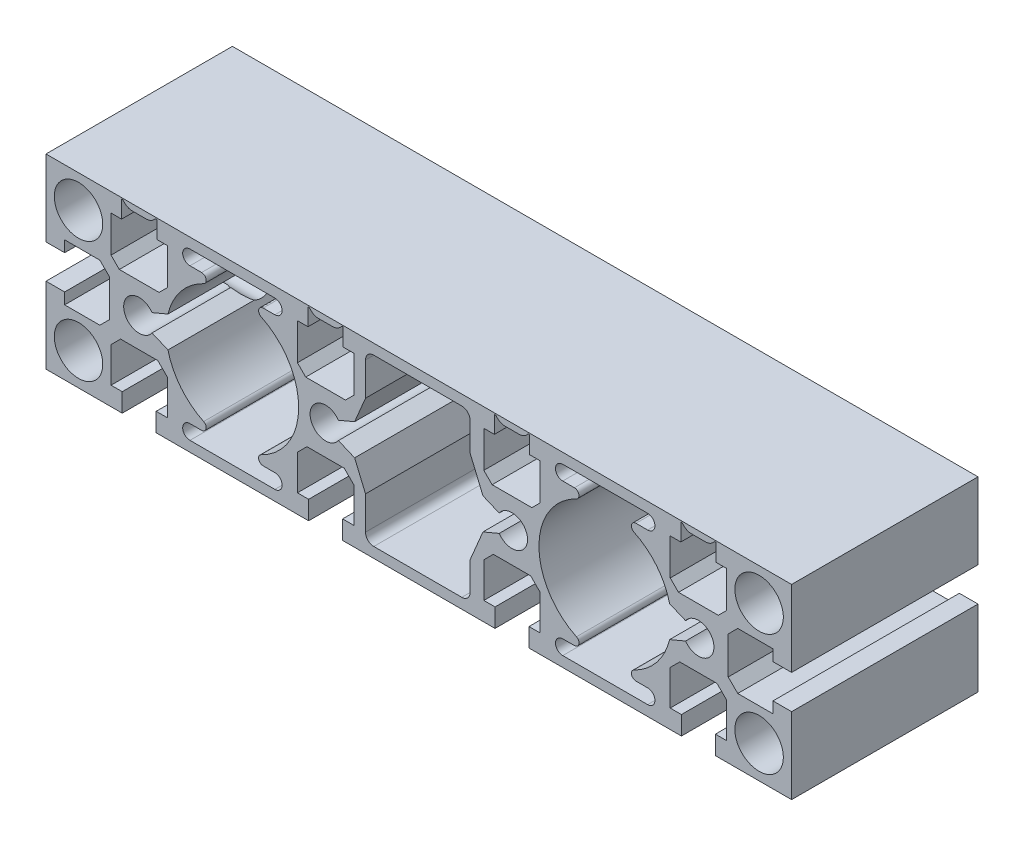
SolidWorks part; units mm, degrees
ref_plane "Front Plane" through (0, 0, 0) normal (0, 0, 1) x (1, 0, 0)
ref_plane "Top Plane" through (0, 0, 0) normal (0, 1, 0) x (1, 0, 0)
ref_plane "Right Plane" through (0, 0, 0) normal (1, 0, 0) x (0, 0, -1)
sketch "Sketch1" plane through (0, 0, 0) normal (0, 0, 1) x (1, 0, 0)
  line L14 (-71.45, 22.2) -> (-70.9822, 21.7322)
  line L15 (-71.75, 22.2) -> (-71.45, 22.2)
  line L16 (-71.75, 18) -> (-71.75, 22.2)
  line L17 (-74.3, 18) -> (-71.75, 18)
  line L18 (-74.3, 9.2) -> (-74.3, 18)
  line L19 (-72.3, 7.2) -> (-74.3, 9.2)
  line L20 (-62.7, 7.2) -> (-72.3, 7.2)
  line L21 (-60.7, 9.2) -> (-62.7, 7.2)
  line L22 (-60.7, 18) -> (-60.7, 9.2)
  line L23 (-63.25, 18) -> (-60.7, 18)
  line L24 (-63.25, 22.2) -> (-63.25, 18)
  line L25 (-63.55, 22.2) -> (-63.25, 22.2)
  line L26 (-64.0177, 21.7323) -> (-63.55, 22.2)
  line L27 (-69.2144, 21) -> (-65.7855, 21)
  line L42 (-26.45, 22.2) -> (-25.9822, 21.7322)
  line L43 (-26.75, 22.2) -> (-26.45, 22.2)
  line L44 (-26.75, 18) -> (-26.75, 22.2)
  line L45 (-29.3, 18) -> (-26.75, 18)
  line L46 (-29.3, 9.2) -> (-29.3, 18)
  line L47 (-27.3, 7.2) -> (-29.3, 9.2)
  line L48 (-17.7, 7.2) -> (-27.3, 7.2)
  line L49 (-15.7, 9.2) -> (-17.7, 7.2)
  line L50 (-15.7, 18) -> (-15.7, 9.2)
  line L51 (-18.25, 18) -> (-15.7, 18)
  line L52 (-18.25, 22.2) -> (-18.25, 18)
  line L53 (-18.55, 22.2) -> (-18.25, 22.2)
  line L54 (-19.0177, 21.7323) -> (-18.55, 22.2)
  line L55 (-24.2144, 21) -> (-20.7855, 21)
  line L128 (-90, 22.5) -> (-90, 4.1)
  line L129 (-90, 4.1) -> (-85.5, 4.1)
  line L130 (-85.5, 4.1) -> (-85.5, 6.8)
  line L131 (-85.5, 6.8) -> (-77, 6.8)
  line L132 (-77, 6.8) -> (-74.7, 4.5)
  line L133 (-74.7, 4.5) -> (-74.7, -4.5)
  line L134 (-74.7, -4.5) -> (-77, -6.8)
  line L135 (-77, -6.8) -> (-85.5, -6.8)
  line L136 (-85.5, -6.8) -> (-85.5, -4.1)
  line L137 (-85.5, -4.1) -> (-90, -4.1)
  line L138 (-90, -4.1) -> (-90, -22.5)
  line L139 (-90, -22.5) -> (-71.6, -22.5)
  line L140 (-71.6, -22.5) -> (-71.6, -18)
  line L141 (-71.6, -18) -> (-74.3, -18)
  line L142 (-74.3, -18) -> (-74.3, -9.5)
  line L143 (-74.3, -9.5) -> (-72, -7.2)
  line L144 (-72, -7.2) -> (-63, -7.2)
  line L145 (-63, -7.2) -> (-60.7, -9.5)
  line L146 (-60.7, -9.5) -> (-60.7, -18)
  line L147 (-60.7, -18) -> (-63.4, -18)
  line L148 (-63.4, -18) -> (-63.4, -22.5)
  line L149 (-63.4, -22.5) -> (-26.6, -22.5)
  line L150 (-26.6, -22.5) -> (-26.6, -18)
  line L151 (-26.6, -18) -> (-29.3, -18)
  line L152 (-29.3, -18) -> (-29.3, -9.5)
  line L153 (-29.3, -9.5) -> (-27, -7.2)
  line L154 (-27, -7.2) -> (-18, -7.2)
  line L155 (-18, -7.2) -> (-15.7, -9.5)
  line L156 (-15.7, -9.5) -> (-15.7, -18)
  line L157 (-15.7, -18) -> (-18.4, -18)
  line L158 (-18.4, -18) -> (-18.4, -22.5)
  line L159 (-18.4, -22.5) -> (18.4, -22.5)
  line L160 (18.4, -22.5) -> (18.4, -18)
  line L161 (18.4, -18) -> (15.7, -18)
  line L162 (15.7, -18) -> (15.7, -9.5)
  line L163 (15.7, -9.5) -> (18, -7.2)
  line L164 (18, -7.2) -> (27, -7.2)
  line L165 (27, -7.2) -> (29.3, -9.5)
  line L166 (29.3, -9.5) -> (29.3, -18)
  line L167 (29.3, -18) -> (26.6, -18)
  line L168 (26.6, -18) -> (26.6, -22.5)
  line L169 (26.6, -22.5) -> (63.4, -22.5)
  line L170 (63.4, -22.5) -> (63.4, -18)
  line L171 (63.4, -18) -> (60.7, -18)
  line L172 (60.7, -18) -> (60.7, -9.5)
  line L173 (60.7, -9.5) -> (63, -7.2)
  line L174 (63, -7.2) -> (72, -7.2)
  line L175 (72, -7.2) -> (74.3, -9.5)
  line L176 (74.3, -9.5) -> (74.3, -18)
  line L177 (74.3, -18) -> (71.6, -18)
  line L178 (71.6, -18) -> (71.6, -22.5)
  line L179 (71.6, -22.5) -> (90, -22.5)
  line L180 (90, -22.5) -> (90, -4.1)
  line L181 (90, -4.1) -> (85.5, -4.1)
  line L182 (85.5, -4.1) -> (85.5, -6.8)
  line L183 (85.5, -6.8) -> (77, -6.8)
  line L184 (77, -6.8) -> (74.7, -4.5)
  line L185 (74.7, -4.5) -> (74.7, 4.5)
  line L186 (74.7, 4.5) -> (77, 6.8)
  line L187 (77, 6.8) -> (85.5, 6.8)
  line L188 (85.5, 6.8) -> (85.5, 4.1)
  line L189 (85.5, 4.1) -> (90, 4.1)
  line L190 (90, 4.1) -> (90, 22.5)
  line L191 (90, 22.5) -> (-90, 22.5)
  line L198 (18.55, 22.2) -> (19.0177, 21.7323)
  line L199 (18.25, 22.2) -> (18.55, 22.2)
  line L200 (18.25, 18) -> (18.25, 22.2)
  line L201 (15.7, 18) -> (18.25, 18)
  line L202 (15.7, 9.2) -> (15.7, 18)
  line L203 (17.7, 7.2) -> (15.7, 9.2)
  line L204 (27.3, 7.2) -> (17.7, 7.2)
  line L205 (29.3, 9.2) -> (27.3, 7.2)
  line L206 (29.3, 18) -> (29.3, 9.2)
  line L207 (26.75, 18) -> (29.3, 18)
  line L208 (26.75, 22.2) -> (26.75, 18)
  line L209 (26.45, 22.2) -> (26.75, 22.2)
  line L210 (25.9822, 21.7322) -> (26.45, 22.2)
  line L211 (20.7855, 21) -> (24.2144, 21)
  line L226 (63.55, 22.2) -> (64.0177, 21.7323)
  line L227 (63.25, 22.2) -> (63.55, 22.2)
  line L228 (63.25, 18) -> (63.25, 22.2)
  line L229 (60.7, 18) -> (63.25, 18)
  line L230 (60.7, 9.2) -> (60.7, 18)
  line L231 (62.7, 7.2) -> (60.7, 9.2)
  line L232 (72.3, 7.2) -> (62.7, 7.2)
  line L233 (74.3, 9.2) -> (72.3, 7.2)
  line L234 (74.3, 18) -> (74.3, 9.2)
  line L235 (71.75, 18) -> (74.3, 18)
  line L236 (71.75, 22.2) -> (71.75, 18)
  line L237 (71.45, 22.2) -> (71.75, 22.2)
  line L238 (70.9822, 21.7322) -> (71.45, 22.2)
  line L239 (65.7855, 21) -> (69.2144, 21)
  line L248 (34.75, -16.5) -> (37.5774, -16.5)
  line L249 (55.25, -20) -> (34.75, -20)
  line L250 (52.4226, -16.5) -> (55.25, -16.5)
  line L251 (64.4102, -2.125) -> (60.5543, -3.75)
  line L252 (60.5543, 3.75) -> (64.4102, 2.125)
  line L253 (55.25, 16.5) -> (52.4226, 16.5)
  line L254 (34.75, 20) -> (55.25, 20)
  line L255 (37.5774, 16.5) -> (34.75, 16.5)
  line L270 (-15.4894, -3.7774) -> (-19.4102, -2.125)
  line L271 (-12.8669, -10) -> (-15.4894, -3.7774)
  line L272 (-12.8669, -18) -> (-12.8669, -10)
  line L273 (10.3831, -20) -> (-10.8669, -20)
  line L274 (12.3831, -11.1481) -> (12.3831, -18)
  line L275 (15.4894, -3.7774) -> (12.3831, -11.1481)
  line L276 (19.4102, -2.125) -> (15.4894, -3.7774)
  line L277 (15.4894, 3.7774) -> (19.4102, 2.125)
  line L278 (12.3831, 11.1481) -> (15.4894, 3.7774)
  line L279 (12.3831, 18) -> (12.3831, 11.1481)
  line L280 (-10.8669, 20) -> (10.3831, 20)
  line L281 (-12.8669, 10) -> (-12.8669, 18)
  line L282 (-15.4894, 3.7774) -> (-12.8669, 10)
  line L283 (-19.4102, 2.125) -> (-15.4894, 3.7774)
  line L292 (-52.4226, 16.5) -> (-55.25, 16.5)
  line L293 (-64.4102, 2.125) -> (-60.5543, 3.75)
  line L294 (-60.5543, -3.75) -> (-64.4102, -2.125)
  line L295 (-55.25, -16.5) -> (-52.4226, -16.5)
  line L296 (-34.75, -20) -> (-55.25, -20)
  line L297 (-37.5774, -16.5) -> (-34.75, -16.5)
  line L298 (-34.75, 16.5) -> (-37.5774, 16.5)
  line L299 (-55.25, 20) -> (-34.75, 20)
  circle A4 centre (82.15, 14.65) radius 5.85
  circle A5 centre (82.15, -14.65) radius 5.85
  circle A6 centre (-82.15, -14.65) radius 5.85
  circle A7 centre (-82.15, 14.65) radius 5.85
  arc A10 (-70.9822, 21.7322) -> (-69.2144, 21) centre (-69.2144, 23.5) ccw
  arc A11 (-65.7855, 21) -> (-64.0177, 21.7323) centre (-65.7855, 23.5) ccw
  arc A14 (-25.9822, 21.7322) -> (-24.2144, 21) centre (-24.2144, 23.5) ccw
  arc A15 (-20.7855, 21) -> (-19.0177, 21.7323) centre (-20.7855, 23.5) ccw
  arc A18 (19.0177, 21.7323) -> (20.7855, 21) centre (20.7855, 23.5) ccw
  arc A19 (24.2144, 21) -> (25.9822, 21.7322) centre (24.2144, 23.5) ccw
  arc A22 (64.0177, 21.7323) -> (65.7855, 21) centre (65.7855, 23.5) ccw
  arc A23 (69.2144, 21) -> (70.9822, 21.7322) centre (69.2144, 23.5) ccw
  arc A36 (37.5774, -16.5) -> (38.0539, -14.4136) centre (37.5774, -15.4024) ccw
  arc A37 (34.75, -16.5) -> (34.75, -20) centre (34.75, -18.25) ccw
  arc A38 (55.25, -20) -> (55.25, -16.5) centre (55.25, -18.25) ccw
  arc A39 (51.9461, -14.4136) -> (52.4226, -16.5) centre (52.4226, -15.4024) ccw
  arc A40 (51.9461, -14.4136) -> (60.5543, -3.75) centre (45, 0) ccw
  arc A41 (64.4102, -2.125) -> (64.4102, 2.125) centre (67.5, 0) ccw
  arc A42 (60.5543, 3.75) -> (51.9461, 14.4136) centre (45, 0) ccw
  arc A43 (52.4226, 16.5) -> (51.9461, 14.4136) centre (52.4226, 15.4024) ccw
  arc A44 (55.25, 16.5) -> (55.25, 20) centre (55.25, 18.25) ccw
  arc A45 (34.75, 20) -> (34.75, 16.5) centre (34.75, 18.25) ccw
  arc A46 (38.0539, 14.4136) -> (37.5774, 16.5) centre (37.5774, 15.4024) ccw
  arc A47 (38.0539, 14.4136) -> (38.0539, -14.4136) centre (45, 0) ccw
  arc A54 (-12.8669, -18) -> (-10.8669, -20) centre (-10.8669, -18) ccw
  arc A55 (10.3831, -20) -> (12.3831, -18) centre (10.3831, -18) ccw
  arc A56 (19.4102, -2.125) -> (19.4102, 2.125) centre (22.5, 0) ccw
  arc A57 (12.3831, 18) -> (10.3831, 20) centre (10.3831, 18) ccw
  arc A58 (-10.8669, 20) -> (-12.8669, 18) centre (-10.8669, 18) ccw
  arc A59 (-19.4102, 2.125) -> (-19.4102, -2.125) centre (-22.5, 0) ccw
  arc A72 (-55.25, 20) -> (-55.25, 16.5) centre (-55.25, 18.25) ccw
  arc A73 (-51.9461, 14.4136) -> (-52.4226, 16.5) centre (-52.4226, 15.4024) ccw
  arc A74 (-51.9461, 14.4136) -> (-60.5543, 3.75) centre (-45, 0) ccw
  arc A75 (-64.4102, 2.125) -> (-64.4102, -2.125) centre (-67.5, 0) ccw
  arc A76 (-60.5543, -3.75) -> (-51.9461, -14.4136) centre (-45, 0) ccw
  arc A77 (-52.4226, -16.5) -> (-51.9461, -14.4136) centre (-52.4226, -15.4024) ccw
  arc A78 (-55.25, -16.5) -> (-55.25, -20) centre (-55.25, -18.25) ccw
  arc A79 (-34.75, -20) -> (-34.75, -16.5) centre (-34.75, -18.25) ccw
  arc A80 (-38.0539, -14.4136) -> (-37.5774, -16.5) centre (-37.5774, -15.4024) ccw
  arc A81 (-38.0539, -14.4136) -> (-38.0539, 14.4136) centre (-45, 0) ccw
  arc A82 (-37.5774, 16.5) -> (-38.0539, 14.4136) centre (-37.5774, 15.4024) ccw
  arc A83 (-34.75, 16.5) -> (-34.75, 20) centre (-34.75, 18.25) ccw
extrude "Extrude1" add sketch "Sketch1" along normal blind 45
sketch "Sketch2" plane through (90, 0, 0) normal (1, 0, 0) x (0, 0, -1)
  line L0 (-45, 4.1) -> (-45, 22.5) construction
  line L1 (-45, 22.5) -> (0, 22.5) construction
  point P0 (-22.5, 0)
  dimension "D1" = 22.5
  dimension "D2" = 22.5
hole_wizard "8.2mm DIA HOLE" positions "3DSketch1" profile "Sketch3" hole size "Ø15.0" standard "Ansi Metric"
sketch3d "3DSketch1"
  point P0 (90, 0, 22.5)
sketch "Sketch3" plane through (90, 0, 22.5) normal (0, 1, 0) x (0, 0, -1)
  line L0 (0, 0) -> (0, 40.5635)
  line L1 (0, 40.5635) -> (4.1, 38.1)
  line L2 (4.1, 38.1) -> (4.1, 0)
  line L5 (4.1, 0) -> (0, 0)
  line L10 (0, 40.5635) -> (-4.1, 38.1) construction
  line L11 (0, -6.35) -> (0, 107.95) construction
  dimension "Hole Dia." = 8.2
  dimension "Hole Depth" = 38.1
  dimension "Drill Angle" = 118
sketch "Sketch4" plane through (-90, 0, 0) normal (-1, 0, 0) x (0, 0, 1)
  circle A0 centre (22.5, 0) radius 4.1 construction
  circle A1 centre (22.5, 0) radius 4.1
hole_wizard "8.2mm DIA  HOLE" positions "3DSketch2" profile "Sketch5" hole size "Ø15.0" standard "Ansi Metric"
sketch3d "3DSketch2"
  point P0 (-90, 0, 22.5)
sketch "Sketch5" plane through (-90, 0, 22.5) normal (0, 1, 0) x (0, 0, 1)
  line L0 (0, 0) -> (0, 40.5635)
  line L1 (0, 40.5635) -> (4.1, 38.1)
  line L2 (4.1, 38.1) -> (4.1, 0)
  line L5 (4.1, 0) -> (0, 0)
  line L10 (0, 40.5635) -> (-4.1, 38.1) construction
  line L11 (0, -6.35) -> (0, 107.95) construction
  dimension "Hole Dia." = 8.2
  dimension "Hole Depth" = 38.1
  dimension "Drill Angle" = 118
